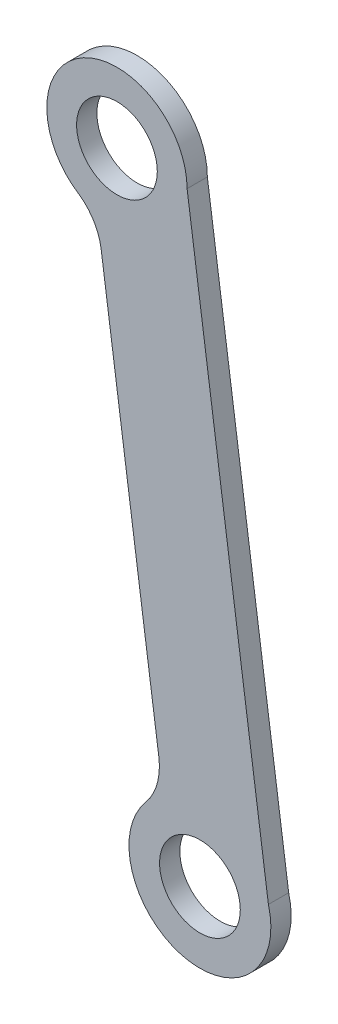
SolidWorks part; units mm, degrees
ref_plane "Plan1" through (0, 0, 0) normal (0, 0, 1) x (1, 0, 0)
ref_plane "Plan2" through (0, 0, 0) normal (0, 1, 0) x (1, 0, 0)
ref_plane "Plan3" through (0, 0, 0) normal (1, 0, 0) x (0, 0, -1)
sketch "Esquisse1" plane through (0, 0, 0) normal (0, 0, 1) x (1, 0, 0)
  line L0 (349.3619, 235.9828) -> (343.6683, 276.5377)
  line L1 (352.1514, 285.9165) -> (360.1747, 228.7666)
  arc A0 (348.054, 231.4314) -> (360.1747, 228.7666) centre (353.4181, 226.932) ccw
  arc A1 (352.1514, 285.9165) -> (341.5238, 280.0737) centre (345.2315, 285.9165) ccw
  arc A2 (349.3619, 235.9828) -> (348.054, 231.4314) centre (343.6024, 235.1742) cw
  arc A3 (343.6683, 276.5377) -> (341.5238, 280.0737) centre (338.4798, 275.8093) ccw
  circle A4 centre (353.4181, 226.932) radius 3.9817
  circle A5 centre (345.2315, 285.9165) radius 3.9817
  dimension "D1" = 59.55
extrude "Base-Extrusion" add sketch "Esquisse1" against normal blind 2
